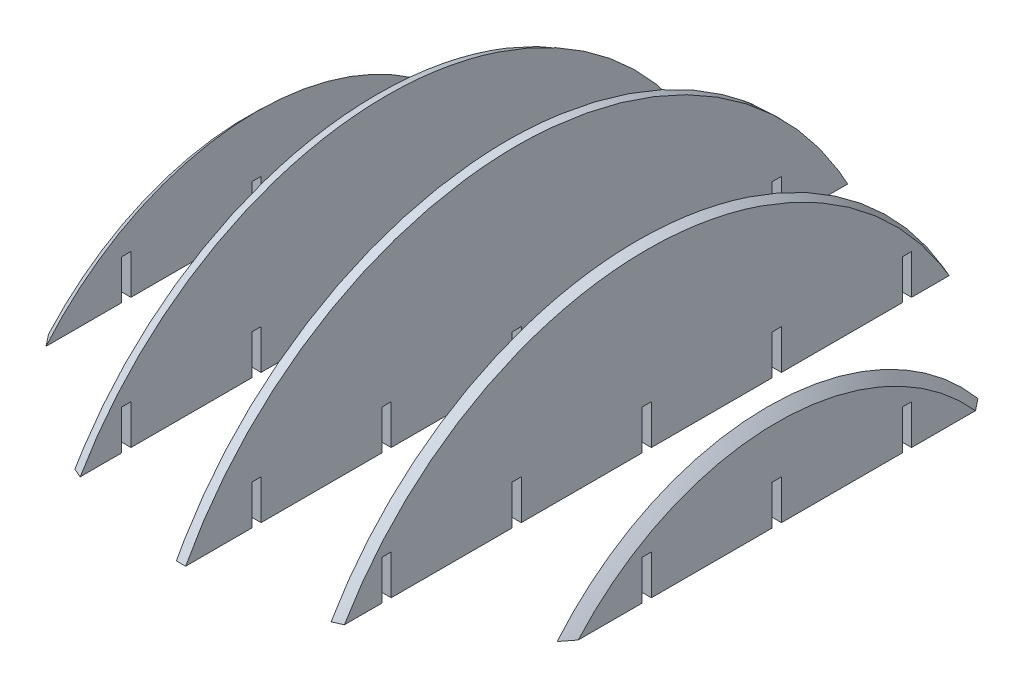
SolidWorks part; units mm, degrees
ref_plane "Front Plane" through (0, 0, 0) normal (0, 0, 1) x (1, 0, 0)
ref_plane "Top Plane" through (0, 0, 0) normal (0, 1, 0) x (1, 0, 0)
ref_plane "Right Plane" through (0, 0, 0) normal (1, 0, 0) x (0, 0, -1)
sketch "Sketch2" plane through (0, 0, 0) normal (0, 0, 1) x (1, 0, 0)
  line L0 (0, 0) -> (100, 0)
  line L1 (0, 60) -> (0, 0) construction
  line L2 (0, 60) -> (58.1194, 60) construction
  line L3 (0, 0) -> (0, 60)
  arc A1 (0, 60) -> (100, 0) centre (0, -53.3333) cw
revolve "Revolve1" add sketch "Sketch2" angle 360 about L3
sketch "Sketch4" [suppressed] plane through (0, 0, 0) normal (0, -1, 0) x (1, 0, 0)
  line L0 (0, -100) -> (0, -80) construction
  line L1 (-100, 1.4) -> (100, 1.4)
  line L2 (-100, 1.4) -> (-100, -1.4)
  line L3 (-100, -1.4) -> (100, -1.4)
  line L4 (100, 1.4) -> (100, -1.4)
  line L5 (100, -40.7) -> (-100, -40.7)
  line L6 (100, -40.7) -> (100, -37.9)
  line L7 (100, -37.9) -> (-100, -37.9)
  line L8 (-100, -40.7) -> (-100, -37.9)
  line L9 (100, -80) -> (-100, -80)
  line L10 (100, -80) -> (100, -77.2)
  line L11 (100, -77.2) -> (-100, -77.2)
  line L12 (-100, -80) -> (-100, -77.2)
  line L13 (0, -77.2) -> (0, -40.7) construction
  line L14 (0, -37.9) -> (0, -1.4) construction
  line L15 (33, 0) -> (-33, 0) construction
  line L16 (0, 77.2) -> (0, 40.7) construction
  line L17 (0, 100) -> (0, 80) construction
  line L18 (-100, 80) -> (-100, 77.2)
  line L19 (100, 77.2) -> (-100, 77.2)
  line L20 (100, 80) -> (100, 77.2)
  line L21 (100, 80) -> (-100, 80)
  line L22 (-100, 40.7) -> (-100, 37.9)
  line L23 (100, 37.9) -> (-100, 37.9)
  line L24 (100, 40.7) -> (100, 37.9)
  line L25 (100, 40.7) -> (-100, 40.7)
  circle A0 centre (0, 0) radius 100 construction
  point P6 (0, -1.4)
  point P8 (100, 0)
extrude "Cut-Extrude1" [suppressed] cut sketch "Sketch4" against normal through all flip side to cut
sketch "Sketch5" plane through (0, 0, 0) normal (0, -1, 0) x (1, 0, 0)
  line L0 (-1.4, 0) -> (-37.9, 0) construction
  line L1 (-1.4, 100) -> (1.4, 100)
  line L2 (-1.4, 100) -> (-1.4, -100)
  line L3 (-1.4, -100) -> (1.4, -100)
  line L4 (1.4, 100) -> (1.4, -100)
  line L5 (-40.7, 100) -> (-37.9, 100)
  line L6 (-40.7, 100) -> (-40.7, -100)
  line L7 (-40.7, -100) -> (-37.9, -100)
  line L8 (-37.9, 100) -> (-37.9, -100)
  line L9 (-80, 100) -> (-77.2, 100)
  line L10 (-80, 100) -> (-80, -100)
  line L11 (-80, -100) -> (-77.2, -100)
  line L12 (-77.2, 100) -> (-77.2, -100)
  line L13 (-40.7, 0) -> (-77.2, 0) construction
  line L14 (-100, 0) -> (-80, 0) construction
  line L15 (0, -33) -> (0, 33) construction
  line L16 (100, 0) -> (80, 0) construction
  line L17 (40.7, 0) -> (77.2, 0) construction
  line L18 (77.2, 100) -> (77.2, -100)
  line L19 (80, -100) -> (77.2, -100)
  line L20 (80, 100) -> (80, -100)
  line L21 (80, 100) -> (77.2, 100)
  line L22 (37.9, 100) -> (37.9, -100)
  line L23 (40.7, -100) -> (37.9, -100)
  line L24 (40.7, 100) -> (40.7, -100)
  line L25 (40.7, 100) -> (37.9, 100)
  circle A0 centre (0, 0) radius 100 construction
  point P6 (0, 100)
  point P8 (-1.4, 0)
extrude "Cut-Extrude2" cut sketch "Sketch5" against normal through all flip side to cut
sketch "Sketch6" plane through (-80, 0, 0) normal (-1, 0, 0) x (0, 0, 1)
  line L0 (60, 0) -> (-60, 0) construction
  line L1 (1.4, 0) -> (-1.4, 0)
  line L2 (1.4, 0) -> (1.4, 12)
  line L3 (1.4, 12) -> (-1.4, 12)
  line L4 (-1.4, 0) -> (-1.4, 12)
  line L6 (-79.9902, 0) -> (-77.1902, 0) construction
  line L7 (-79.9902, 0) -> (-79.9902, 12) construction
  line L8 (-79.9902, 12) -> (-77.1902, 12) construction
  line L9 (-77.1902, 0) -> (-77.1902, 12) construction
  line L10 (-40.6951, 0) -> (-37.8951, 0)
  line L11 (-40.6951, 0) -> (-40.6951, 12)
  line L12 (-40.6951, 12) -> (-37.8951, 12)
  line L13 (-37.8951, 0) -> (-37.8951, 12)
  line L14 (-37.8951, 12) -> (-1.4, 12) construction
  line L15 (-79.9902, 12) -> (-99.9902, 12) construction
  line L16 (0, -33) -> (0, 33) construction
  line L17 (-40.6951, 12) -> (-77.1902, 12) construction
  line L18 (-99.9902, 12) -> (-99.9902, 3.7003) construction
  line L19 (37.8951, 0) -> (37.8951, 12)
  line L20 (40.6951, 12) -> (37.8951, 12)
  line L21 (40.6951, 0) -> (40.6951, 12)
  line L22 (40.6951, 0) -> (37.8951, 0)
  line L23 (77.1902, 0) -> (77.1902, 12) construction
  line L24 (79.9902, 12) -> (77.1902, 12) construction
  line L25 (79.9902, 0) -> (79.9902, 12) construction
  line L26 (79.9902, 0) -> (77.1902, 0) construction
extrude "Cut-Extrude4" cut sketch "Sketch6" against normal up to surface (160 mm away)
sketch "Sketch7" plane through (-40.7, 0, 0) normal (-1, 0, 0) x (0, 0, 1)
  line L1 (-79.9902, 12) -> (-77.1902, 12)
  line L2 (-79.9902, 12) -> (-79.9902, 0)
  line L3 (-79.9902, 0) -> (-77.1902, 0)
  line L4 (-77.1902, 12) -> (-77.1902, 0)
  line L5 (77.1902, 12) -> (79.9902, 12)
  line L6 (77.1902, 12) -> (77.1902, 0)
  line L7 (77.1902, 0) -> (79.9902, 0)
  line L8 (79.9902, 12) -> (79.9902, 0)
extrude "Cut-Extrude5" cut sketch "Sketch7" against normal up to surface (81.4 mm away)
sketch "Sketch8" [suppressed] plane through (0, 0, -80) normal (0, 0, -1) x (-1, 0, 0)
  line L0 (-77.2, 42.35) -> (-40.7, 42.35) construction
  line L1 (-1.4, 64.8245) -> (1.4, 64.8245)
  line L2 (-1.4, 64.8245) -> (-1.4, 12)
  line L3 (-1.4, 12) -> (1.4, 12)
  line L4 (1.4, 64.8245) -> (1.4, 12)
  line L5 (-40.7, 63.6671) -> (-37.9, 63.6671)
  line L6 (-40.7, 63.6671) -> (-40.7, 12)
  line L7 (-40.7, 12) -> (-37.9, 12)
  line L8 (-37.9, 63.6671) -> (-37.9, 12)
  line L9 (-80, 72.6999) -> (-77.2, 72.6999)
  line L10 (-80, 72.6999) -> (-80, 12)
  line L11 (-80, 12) -> (-77.2, 12)
  line L12 (-77.2, 72.6999) -> (-77.2, 12)
  line L13 (-37.9, 42.35) -> (-1.4, 42.35) construction
  line L14 (-80, 42.35) -> (-100, 42.35) construction
  line L15 (-100, 42.35) -> (-100, 0) construction
  line L16 (60, 0) -> (-60, 0) construction
  line L17 (0, 33) -> (0, -33) construction
  line L18 (80, 42.35) -> (100, 42.35) construction
  line L19 (77.2, 42.35) -> (40.7, 42.35) construction
  line L20 (77.2, 72.6999) -> (77.2, 12)
  line L21 (80, 12) -> (77.2, 12)
  line L22 (80, 72.6999) -> (80, 12)
  line L23 (80, 72.6999) -> (77.2, 72.6999)
  line L24 (37.9, 63.6671) -> (37.9, 12)
  line L25 (40.7, 12) -> (37.9, 12)
  line L26 (40.7, 63.6671) -> (40.7, 12)
  line L27 (40.7, 63.6671) -> (37.9, 63.6671)
  point P12 (0, 12)
extrude "Cut-Extrude6" [suppressed] cut sketch "Sketch8" against normal through all
equation "\"Diameter\"= 200"
equation "\"Height\"= 60"
equation "\"Th\"= 2.8"
equation "\"D2@Sketch2\"=\"Height\""
equation "\"D1@Sketch2\"=\"Diameter\""
equation "\"D1@Sketch4\"=\"Th\""
equation "\"D1@Sketch5\"=\"Th\""
equation "\"D1@Sketch6\"=\"Th\""
equation "\"D1@Sketch8\"=\"Th\""
